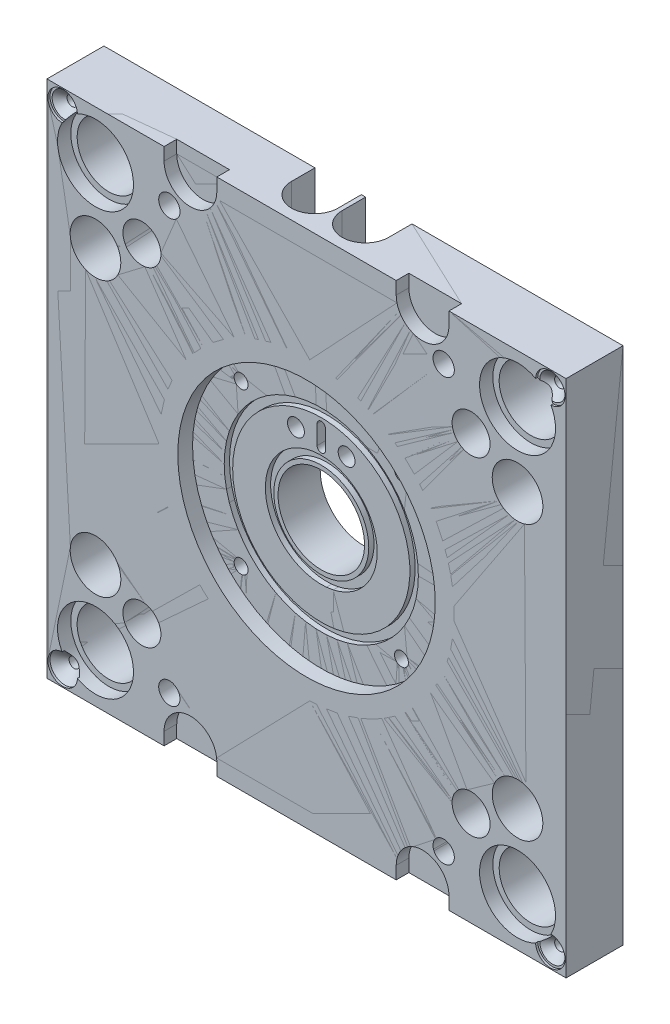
SolidWorks part; units mm, degrees
ref_plane "Plan de face" through (0, 0, 0) normal (0, 0, 1) x (1, 0, 0)
ref_plane "Plan de dessus" through (0, 0, 0) normal (0, 1, 0) x (1, 0, 0)
ref_plane "Plan de droite" through (0, 0, 0) normal (1, 0, 0) x (0, 0, -1)
imported_body "Importée1"
sketch "Esquisse1" plane through (0, 0, 20) normal (0, 0, 1) x (1, 0, 0)
  circle A0 centre (0, 0) radius 70
  dimension "D1" = 140
extrude "Enlèv. mat.-Extru.1" cut sketch "Esquisse1" along normal through all
sketch "Esquisse2" plane through (0, 0, 0) normal (0, 0, -1) x (-1, 0, 0)
  line L0 (123, -123) -> (100, -100)
  line L1 (100, -100) -> (100, -65)
  line L2 (100, -65) -> (38, -38)
  line L4 (38, -38) -> (0, 0)
  line L5 (0, 0) -> (0, 73.346)
  line L6 (0, 73.346) -> (-11.969, 84.9202)
  line L7 (-11.969, 84.9202) -> (-11.969, 123)
  line L9 (-11.969, 123) -> (-24.7466, 123)
  line L10 (123, 123) -> (123, -123)
  line L11 (-123, 123) -> (-23, 123) construction
  line L12 (-24.7466, 123) -> (-65, 100)
  line L13 (-78, 78) -> (-100, 65)
  line L14 (-100, 65) -> (-123, 65)
  line L15 (-123, -123) -> (-123, 123) construction
  line L16 (-123, 65) -> (-123, 132.5554)
  line L17 (-123, 132.5554) -> (123, 123)
  line L18 (-65, 100) -> (-78, 78)
extrude "Mask" cut sketch "Esquisse2" against normal through all
